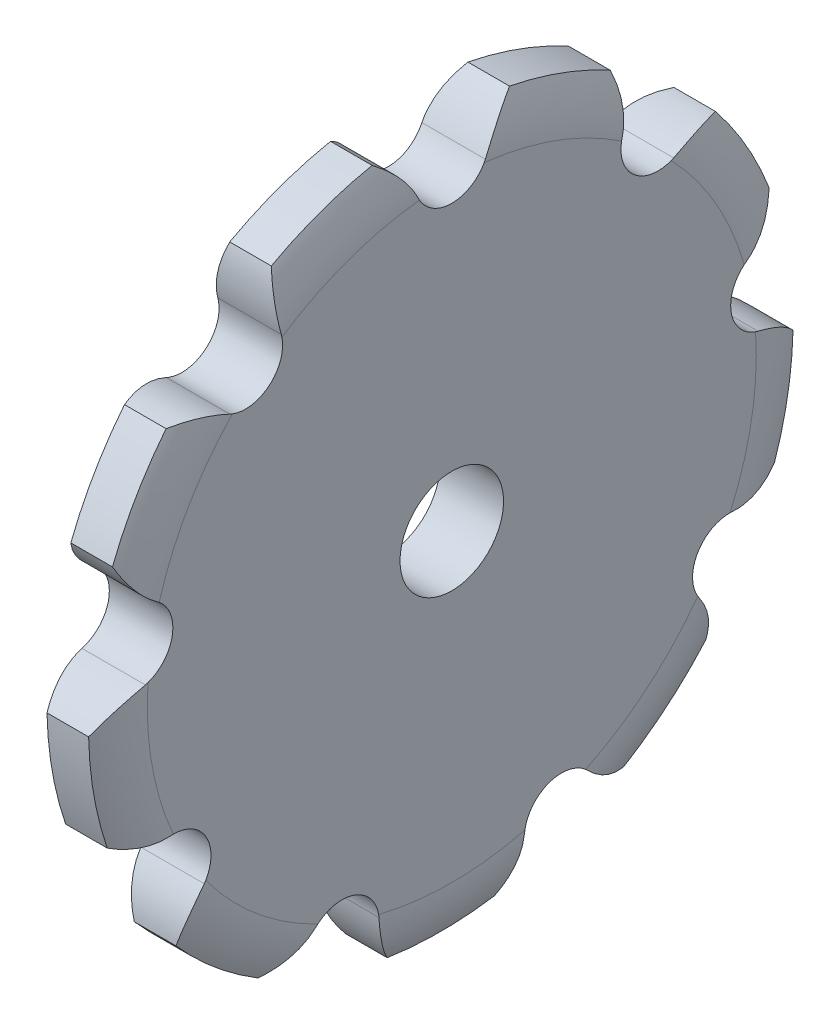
SolidWorks part; units mm, degrees
ref_plane "Plane1" through (0, 0, 0) normal (0, 0, 1) x (1, 0, 0)
ref_plane "Plane2" through (0, 0, 0) normal (0, 1, 0) x (1, 0, 0)
ref_plane "Plane3" through (0, 0, 0) normal (1, 0, 0) x (0, 0, -1)
sketch "Clipboard" plane through (0, 0, 0) normal (0, 1, 0) x (1, 0, 0)
  line L0 (0, 0) -> (25.0873, -3.9734)
  line L1 (-15, 0) -> (100, 0) construction
  line L2 (0, 0) -> (-0.8416, 0.9512)
  line L3 (0, 0) -> (-11.863, 4.5341)
  line L4 (0, 0) -> (3.0618, 0.4849)
  line L5 (0, 0) -> (-2.8109, -1.0484)
  line L6 (0, 0) -> (-6.1032, -4.1179)
  line L7 (-0.8416, 0.9512) -> (9.364, 2.7507)
  line L8 (-76.2, 38.1) -> (-75.2, 38.1)
  line L9 (-73.4361, 41.7391) -> (-72.4443, 41.8673)
  line L10 (-73.4741, 12.7512) -> (-59.5541, 12.7512)
  line L11 (-73.4741, 12.7512) -> (-59.1042, 12.5003)
  line L12 (-147.5013, -35.8225) -> (-147.5932, -35.8997)
  circle A0 centre (0, 0) radius 4.255
  circle A1 centre (0, 0) radius 25
  circle A2 centre (0, 0) radius 25
sketch "BasProSke" plane through (0, 0, 0) normal (0, 1, 0) x (1, 0, 0)
  line L0 (-10, 0) -> (60, 0) construction
  line L1 (0, 0) -> (0, 35.279)
  line L2 (0, 0) -> (7.3625, 0)
  line L3 (7.3625, 0) -> (7.3625, 35.279)
  line L4 (6.0925, 40.8148) -> (1.27, 40.8148)
  arc A0 (0, 35.279) -> (1.27, 40.8148) centre (12.7, 35.279) cw
  arc A1 (7.3625, 35.279) -> (6.0925, 40.8148) centre (-5.3375, 35.279) ccw
revolve "Base-Revolve" add sketch "BasProSke" angle 360 about L0
sketch "TooCutSke" plane through (0, 0, 0) normal (1, 0, 0) x (0, 0, -1)
  line L0 (0, 37.1749) -> (3.8949, 35.3586) construction
  line L1 (0, 0) -> (0, 107) construction
  line L2 (0, 37.1749) -> (-10, 37.1749) construction
  line L3 (0, 37.1749) -> (-3.8949, 35.3586) construction
  arc A0 (3.8949, 35.3586) -> (7.9688, 40.0395) centre (14.0756, 30.6113) cw
  arc A1 (3.8949, 35.3586) -> (-3.8949, 35.3586) centre (0, 37.1749) cw
  arc A2 (-3.8949, 35.3586) -> (-7.9688, 40.0395) centre (-14.0756, 30.6113) ccw
  arc A3 (7.9688, 40.0395) -> (-7.9688, 40.0395) centre (0, 0) ccw
extrude "ToothCut" cut sketch "TooCutSke" along normal through all
pattern_circular "TeethCuts" count 9 every 40 about axis through (-10, 0, 0) along (1, 0, 0) of "ToothCut"
sketch "HubNeaOneSke" plane through (0, 0, 0) normal (-1, 0, 0) x (0, 0, 1)
  circle A0 centre (0, 0) radius 25
extrude "HubNearOne" [suppressed] add sketch "HubNeaOneSke" along normal blind 3.0005
fillet "HubNearOneFillet" [suppressed] radius 1
sketch "HubNeaBotSke" plane through (0, 0, 0) normal (-1, 0, 0) x (0, 0, 1)
  circle A0 centre (0, 0) radius 25
extrude "HubNearBoth" [suppressed] add sketch "HubNeaBotSke" along normal blind 1.5003
fillet "HubNearBothFillet" [suppressed] radius 1
ref_plane "FarPln" through (7.3625, 0, 0) normal (1, 0, 0) x (0, 0, -1)
sketch "HubFarSke" plane through (7.3625, 0, 0) normal (1, 0, 0) x (0, 0, -1)
  circle A0 centre (0, 0) radius 25
extrude "HubFar" [suppressed] add sketch "HubFarSke" along normal blind 1.5003
fillet "HubFarFillet" [suppressed] radius 1
sketch "BorSke" plane through (0, 0, 0) normal (1, 0, 0) x (0, 0, -1)
  circle A0 centre (0, 0) radius 6
extrude "Bore" cut sketch "BorSke" along normal mid plane 20.726
sketch "KeySke" plane through (0, 0, 0) normal (1, 0, 0) x (0, 0, -1)
  line L0 (-1, 0) -> (-1, 7)
  line L1 (-1, 7) -> (1, 7)
  line L2 (1, 7) -> (1, 0)
  line L3 (0, 0) -> (0, 34) construction
  line L4 (-1, 0) -> (1, 0)
extrude "Keyway" [suppressed] cut sketch "KeySke" along normal mid plane 20.726
pattern_circular "Keyway2" [suppressed] count 2 every 90 about axis through (-10, 0, 0) along (1, 0, 0)
equation "' \"Pitch@Clipboard\" = 25.4"
equation "' \"Num_teeth@Clipboard\" = 9"
equation "' \"Hub_dia@Clipboard\" = 50"
equation "' \"Overall_len@Clipboard\" = 3"
equation "' \"Diameter@BorSke\" = 12"
equation "' \"T_dim@Clipboard\" = 1"
equation "' \"Width@KeySke\" = 2"
equation "' \"Dr@Clipboard\" = 8.51"
equation "' \"Face_width@Clipboard\" = 7.3625"
equation "' \"Side_radius@Clipboard\" = 12.7"
equation "' \"Side_relief@Clipboard\" = 1.27"
equation "' \"Show_teeth@Clipboard\" = 9"
equation "' \"Fillet_rad@Clipboard\" = 1"
equation "' \"Plate_wid@Clipboard\" = 11.8"
equation "'  \"Cut@Clipboard\" = 1"
equation "'  \"GapAngle@Clipboard\" = 140"
equation "'  \"GapFactor@Clipboard\" = 0.12"
equation "' \"Num_teeth@Clipboard\" = int( \"Num_teeth@Clipboard\" )"
equation "\"Num_teeth@Clipboard\" = ((sgn( \"Num_teeth@Clipboard\" - 5.0)+1)*( \"Num_teeth@Clipboard\" - 5.0))/2 +5.0"
equation "\"Num_teeth@Clipboard\" = ((sgn( \"Num_teeth@Clipboard\" - 200.0)-1)*( \"Num_teeth@Clipboard\" - 200.0))/-2 +200.0"
equation "\"MHD@Clipboard\" = \"Pitch@Clipboard\" * (1.0 / tan(3.14159265 / \"Num_teeth@Clipboard\" )) - 1.05 * \"Plate_wid@Clipboard\" - 2.0 * \"Fillet_rad@Clipboard\" - 1.0"
equation "\"Thickness@Clipboard\"  = \"Face_width@Clipboard\" + (\"Num_strands@Clipboard\" - 1) * \"Transv_pitch@Clipboard\""
equation "\"OAL@Clipboard\" = \"Thickness@Clipboard\" + 2 * \"Fillet_rad@Clipboard\" + 1"
equation "\"MHD@Clipboard\" = ((sgn( \"MHD@Clipboard\" - \"Hub_dia@Clipboard\" )-1)*( \"MHD@Clipboard\" - \"Hub_dia@Clipboard\" ))/-2+ \"Hub_dia@Clipboard\""
equation "\"OAL@Clipboard\" = ((sgn( \"OAL@Clipboard\" - \"Overall_len@Clipboard\" )+1)*( \"OAL@Clipboard\" - \"Overall_len@Clipboard\" ))/2 + \"Overall_len@Clipboard\" + 0.0005"
equation "\"Num_teeth@TeethCuts\" = int( \"Show_teeth@Clipboard\" ) + 1"
equation "\"Num_teeth@TeethCuts\" = ((sgn( \"Num_teeth@TeethCuts\" - \"Num_teeth@Clipboard\" )-1)*( \"Num_teeth@TeethCuts\" - \"Num_teeth@Clipboard\" ))/-2+ \"Num_teeth@Clipboard\""
equation "\"Num_teeth@TeethCuts\" = ((sgn( \"Num_teeth@TeethCuts\" - 2.0)+1)*( \"Num_teeth@TeethCuts\" - 2.0))/2 +2.0"
equation "\"Angle@TeethCuts\" = 360.0 / \"Num_teeth@Clipboard\""
equation "\"Num_teeth@TeethCuts\" = \"Num_teeth@TeethCuts\" * \"Cut@Clipboard\""
equation "\"Angle@TeethCuts\" = \"Angle@TeethCuts\" / \"Cut@Clipboard\""
equation "\"Seat_radius@TooCutSke\" = ( \"Pitch@Clipboard\" / 2.0) / sin(3.14159265 / \"Num_teeth@Clipboard\" ) - \"Dr@Clipboard\" / 2.0 + \"Dr@Clipboard\" * 0.505"
equation "\"R1@TooCutSke\"  = \"Dr@Clipboard\" * 0.505"
equation "\"X@TooCutSke\" = \"GapAngle@Clipboard\" - (90.0 / \"Num_teeth@Clipboard\")"
equation "\"R2@TooCutSke\" = \"GapFactor@Clipboard\"  * \"Dr@Clipboard\" * ( \"Num_teeth@Clipboard\" + 2.0)"
equation "' \"R2@TooCutSke\" = 0.008 * \"Dr@Clipboard\" * ( \"Num_teeth@Clipboard\" * \"Num_teeth@Clipboard\" + 180)"
equation "\"Overcut@TooCutSke\" = 0.01 + 0.625 / 2 * \"Pitch@Clipboard\" - 0.5 * \"Dr@Clipboard\"  +  \"Pitch@Clipboard\" / 2.0 / sin(3.14159265 / \"Num_teeth@Clipboard\" )"
equation "\"Diameter@BasProSke\" = 2.0 * ( 0.625 / 2 * \"Pitch@Clipboard\" - 0.5 * \"Dr@Clipboard\"  +  \"Pitch@Clipboard\" / 2.0 / sin(3.14159265 / \"Num_teeth@Clipboard\" ))"
equation "\"Thickness@BasProSke\"  = \"Thickness@Clipboard\""
equation "\"G1@BasProSke\" =  \"Side_relief@Clipboard\""
equation "\"G2@BasProSke\" =  \"Side_relief@Clipboard\""
equation "\"D1@BasProSke\" =  \"Side_radius@Clipboard\""
equation "\"Diameter@HubNeaOneSke\" = \"MHD@Clipboard\""
equation "\"Length@HubNearOne\" = \"OAL@Clipboard\" - \"Thickness@BasProSke\""
equation "\"Diameter@HubNeaBotSke\" = \"MHD@Clipboard\""
equation "\"Length@HubNearBoth\" = ( \"OAL@Clipboard\" - \"Thickness@BasProSke\" ) / 2.0"
equation "\"D1@HubNearOneFillet\" = \"Fillet_rad@Clipboard\""
equation "\"D1@HubNearBothFillet\" = \"Fillet_rad@Clipboard\""
equation "\"Thickness@FarPln\" = \"Thickness@BasProSke\""
equation "\"Diameter@HubFarSke\" = \"MHD@Clipboard\""
equation "\"Length@HubFar\" = ( \"OAL@Clipboard\" - \"Thickness@BasProSke\" ) / 2.0"
equation "\"D1@HubFarFillet\" = \"Fillet_rad@Clipboard\""
equation "\"D1@Bore\" = \"OAL@Clipboard\" * 2.0"
equation "\"D1@Keyway\" = \"OAL@Clipboard\" * 2.0"
equation "\"Offset@KeySke\" = \"T_dim@Clipboard\" + \"Diameter@BorSke\" / 2.0"
